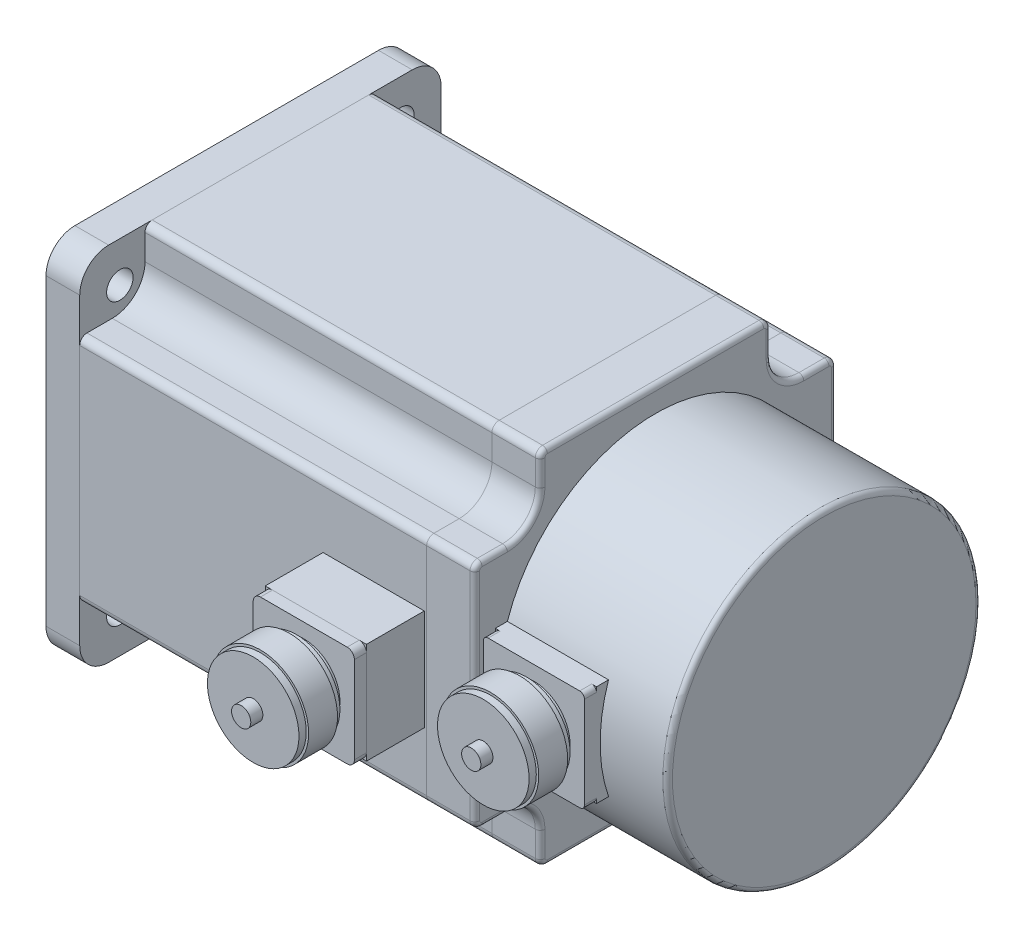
SolidWorks part; units mm, degrees
ref_plane "前视基准面" through (0, 0, 0) normal (0, 0, 1) x (1, 0, 0)
ref_plane "上视基准面" through (0, 0, 0) normal (0, 1, 0) x (1, 0, 0)
ref_plane "右视基准面" through (0, 0, 0) normal (1, 0, 0) x (0, 0, -1)
sketch "草图1" plane through (0, 0, 0) normal (1, 0, 0) x (0, 0, -1)
  line L1 (-63, -75) -> (63, -75)
  line L2 (-75, -63) -> (-75, 63)
  line L3 (-63, 75) -> (63, 75)
  line L4 (75, -63) -> (75, 63)
  line L5 (-75, -75) -> (75, 75) construction
  line L6 (-75, 75) -> (75, -75) construction
  arc A0 (63, -75) -> (75, -63) centre (63, -63) ccw
  arc A1 (-63, -75) -> (-75, -63) centre (-63, -63) cw
  arc A2 (-75, 63) -> (-63, 75) centre (-63, 63) cw
  arc A3 (63, 75) -> (75, 63) centre (63, 63) cw
  point P0 (0, 0)
  dimension "D1" = 12
extrude "凸台-拉伸1" add sketch "草图1" along normal blind 20
sketch "草图2" plane through (0, 0, 0) normal (-1, 0, 0) x (0, 0, 1)
  line L0 (-63, 75) -> (63, 75) construction
  line L1 (-63, -75) -> (63, -75)
  line L2 (-75, -63) -> (-75, 63)
  line L3 (-63, 75) -> (63, 75)
  line L4 (75, -63) -> (75, 63)
  line L5 (-75, -75) -> (75, 75) construction
  line L6 (-75, 75) -> (75, -75) construction
  arc A0 (63, 75) -> (75, 63) centre (63, 63) cw
  arc A1 (63, -75) -> (75, -63) centre (63, -63) ccw
  arc A2 (-63, -75) -> (-75, -63) centre (-63, -63) cw
  arc A3 (-75, 63) -> (-63, 75) centre (-63, 63) cw
  point P0 (0, 0)
  dimension "D1" = 12
extrude "凸台-拉伸2" add sketch "草图2" along normal blind 144 separate body
sketch "草图3" plane through (-144, 0, 0) normal (-1, 0, 0) x (0, 0, 1)
  line L0 (63, 75) -> (-63, 75) construction
  line L1 (-63, -75) -> (63, -75)
  line L2 (-75, -63) -> (-75, 63)
  line L3 (-63, 75) -> (63, 75)
  line L4 (75, -63) -> (75, 63)
  line L5 (-75, -75) -> (75, 75) construction
  line L6 (-75, 75) -> (75, -75) construction
  arc A0 (-63, -75) -> (-75, -63) centre (-63, -63) cw
  arc A1 (63, -75) -> (75, -63) centre (63, -63) ccw
  arc A2 (63, 75) -> (75, 63) centre (63, 63) cw
  arc A3 (-75, 63) -> (-63, 75) centre (-63, 63) cw
  point P0 (0, 0)
  dimension "D1" = 12
extrude "凸台-拉伸3" add sketch "草图3" along normal blind 14 separate body
sketch "草图4" plane through (0, 0, 75) normal (0, 0, 1) x (1, 0, 0)
  line L2 (-43, -21) -> (-1, -21)
  line L3 (-43, -21) -> (-43, 21)
  line L4 (-43, 21) -> (-1, 21)
  line L5 (-1, -21) -> (-1, 21)
  line L6 (-43, -21) -> (-1, 21) construction
  line L7 (-43, 21) -> (-1, -21) construction
extrude "凸台-拉伸4" add sketch "草图4" along normal blind 24 separate body
sketch "草图5" plane through (0, 0, 99) normal (0, 0, 1) x (1, 0, 0)
  line L0 (-1, 21) -> (-43, 21) construction
  line L1 (-40, -21) -> (-4, -21)
  line L2 (-43, -18) -> (-43, 18)
  line L3 (-40, 21) -> (-4, 21)
  line L4 (-1, -18) -> (-1, 18)
  line L5 (-43, -21) -> (-1, 21) construction
  line L6 (-43, 21) -> (-1, -21) construction
  arc A0 (-40, -21) -> (-43, -18) centre (-40, -18) cw
  arc A1 (-4, -21) -> (-1, -18) centre (-4, -18) ccw
  arc A2 (-4, 21) -> (-1, 18) centre (-4, 18) cw
  arc A3 (-43, 18) -> (-40, 21) centre (-40, 18) cw
  point P0 (-22, 0)
  dimension "D1" = 3
extrude "凸台-拉伸5" add sketch "草图5" along normal blind 5 separate body
sketch "草图6" plane through (0, 0, 104) normal (0, 0, 1) x (1, 0, 0)
  circle A0 centre (-22, 0) radius 15
extrude "凸台-拉伸6" add sketch "草图6" along normal blind 3 separate body
sketch "草图7" plane through (0, 0, 107) normal (0, 0, 1) x (1, 0, 0)
  circle A0 centre (-22, 0) radius 18
extrude "凸台-拉伸7" add sketch "草图7" along normal blind 3 separate body
sketch "草图8" plane through (0, 0, 110) normal (0, 0, 1) x (1, 0, 0)
  circle A0 centre (-22, 0) radius 20
extrude "凸台-拉伸8" add sketch "草图8" along normal blind 12 separate body
sketch "草图9" plane through (0, 0, 122) normal (0, 0, 1) x (1, 0, 0)
  circle A0 centre (-22, 0) radius 19
extrude "凸台-拉伸9" add sketch "草图9" along normal blind 3
sketch "草图10" plane through (0, 0, 125) normal (0, 0, 1) x (1, 0, 0)
  circle A0 centre (-22, 0) radius 4
extrude "凸台-拉伸10" add sketch "草图10" along normal blind 5
sketch "草图11" plane through (20, 0, 0) normal (1, 0, 0) x (0, 0, -1)
  line L0 (47.9169, -61.5) -> (47.9169, -72)
  line L1 (-75, -44.9169) -> (-75, -63)
  line L2 (-63, -75) -> (-44.9169, -75)
  line L3 (44.9169, -75) -> (63, -75)
  line L4 (75, -63) -> (75, -44.9169)
  line L6 (75, 63) -> (75, 44.9169)
  line L7 (-63, -75) -> (63, -75) construction
  line L8 (63, 75) -> (44.9169, 75)
  line L9 (-47.9169, -72) -> (-47.9169, -61.5)
  line L10 (-44.9169, 75) -> (-63, 75)
  line L11 (-61.5, -47.9169) -> (-72, -47.9169)
  line L12 (75, -63) -> (75, 63) construction
  line L13 (-75, 63) -> (-75, 44.9169)
  line L14 (-72, 47.9169) -> (-61.5, 47.9169)
  line L16 (-47.9169, 61.5) -> (-47.9169, 72)
  line L17 (63, 75) -> (-63, 75) construction
  line L19 (47.9169, 72) -> (47.9169, 61.5)
  line L21 (61.5, 47.9169) -> (72, 47.9169)
  line L22 (-75, 63) -> (-75, -63) construction
  line L24 (72, -47.9169) -> (61.5, -47.9169)
  arc A0 (-61.5, 47.9169) -> (-47.9169, 61.5) centre (-61.5, 61.5) ccw
  arc A1 (47.9169, 61.5) -> (61.5, 47.9169) centre (61.5, 61.5) ccw
  arc A2 (-47.9169, -61.5) -> (-61.5, -47.9169) centre (-61.5, -61.5) ccw
  arc A3 (-72, -47.9169) -> (-75, -44.9169) centre (-72, -44.9169) cw
  arc A4 (61.5, -47.9169) -> (47.9169, -61.5) centre (61.5, -61.5) ccw
  arc A5 (-75, 44.9169) -> (-72, 47.9169) centre (-72, 44.9169) cw
  arc A6 (-47.9169, 72) -> (-44.9169, 75) centre (-44.9169, 72) cw
  arc A7 (44.9169, 75) -> (47.9169, 72) centre (44.9169, 72) cw
  arc A8 (72, 47.9169) -> (75, 44.9169) centre (72, 44.9169) cw
  arc A9 (75, -44.9169) -> (72, -47.9169) centre (72, -44.9169) cw
  arc A10 (47.9169, -72) -> (44.9169, -75) centre (44.9169, -72) cw
  arc A11 (-44.9169, -75) -> (-47.9169, -72) centre (-44.9169, -72) cw
  arc A12 (-63, 75) -> (-75, 63) centre (-63, 63) ccw
  arc A13 (75, 63) -> (63, 75) centre (63, 63) ccw
  arc A14 (63, -75) -> (75, -63) centre (63, -63) ccw
  arc A15 (-75, -63) -> (-63, -75) centre (-63, -63) ccw
  point P0 (0, 0)
  point P1 (0, 0)
  point P12 (-75, -47.9169)
  point P43 (-75, 47.9169)
  point P47 (-47.9169, 75)
  point P48 (51.9891, -75)
  point P52 (47.9169, 75)
  point P56 (75, 47.9169)
  point P65 (75, -47.9169)
  point P82 (-47.9169, -75)
  dimension "D1" = 3
extrude "切除-拉伸2" cut sketch "草图11" against normal blind 164
fillet "圆角1" radius 2 24 edges at (20, 75, 0) (20, 0, -75) (20, -75, 0) (20, 0, 75) (20, 47.0382, 74.1213) (20, 47.9169, 66.75) (20, 51.8953, 51.8953) (20, 66.75, 47.9169) (20, 74.1213, 47.0382) (20, 74.1213, -47.0382) (20, 66.75, -47.9169) (20, 51.8953, -51.8953) (20, 47.9169, -66.75) (20, 47.0382, -74.1213) (20, -47.0382, -74.1213) (20, -47.9169, -66.75) (20, -51.8953, -51.8953) (20, -66.75, -47.9169) (20, -74.1213, -47.0382) (20, -74.1213, 47.0382) (20, -66.75, 47.9169) (20, -51.8953, 51.8953) (20, -47.9169, 66.75) (20, -47.0382, 74.1213)
sketch "草图12" plane through (-158, 0, 0) normal (-1, 0, 0) x (0, 0, 1)
  circle A2 centre (-58.3363, 58.3363) radius 5.5
  circle A3 centre (58.3363, 58.3363) radius 5.5
  circle A4 centre (58.3363, -58.3363) radius 5.5
  circle A5 centre (-58.3363, -58.3363) radius 5.5
extrude "切除-拉伸3" cut sketch "草图12" against normal blind 14
sketch "草图13" plane through (-158, 0, 0) normal (-1, 0, 0) x (0, 0, 1)
  circle A0 centre (0, 0) radius 65
  circle A1 centre (0, 0) radius 57.5
extrude "凸台-拉伸11" add sketch "草图13" along normal blind 5 separate body
sketch "草图14" plane through (-158, 0, 0) normal (-1, 0, 0) x (0, 0, 1)
  circle A0 centre (0, 0) radius 35
extrude "凸台-拉伸12" add sketch "草图14" along normal blind 5
sketch "草图15" plane through (-163, 0, 0) normal (-1, 0, 0) x (0, 0, 1)
  circle A0 centre (0, 0) radius 17.5
extrude "凸台-拉伸13" add sketch "草图15" along normal blind 0.5 separate body
fillet "圆角2" radius 0.5 1 edges at (-163.5, 0, 17.5)
sketch "草图16" plane through (-163.5, 0, 0) normal (-1, 0, 0) x (0, 0, 1)
  circle A0 centre (0, 0) radius 14
extrude "凸台-拉伸14" add sketch "草图16" along normal blind 52.5
chamfer "倒角1" distance 0.5 angle 45 1 edges at (-216, 0, 14)
ref_plane "基准面1" through (0, -14, 0) normal (0, 1, 0) x (1, 0, 0)
sketch "草图19" plane through (20, 0, 0) normal (1, 0, 0) x (0, 0, -1)
  circle A0 centre (0, 0) radius 65
extrude "凸台-拉伸16" add sketch "草图19" along normal blind 70 separate body
fillet "圆角3" radius 2 1 edges at (90, 0, -65)
ref_plane "基准面2" through (0, 0, 65) normal (0, 0, 1) x (1, 0, 0)
sketch "草图20" plane through (0, 0, 65) normal (0, 0, 1) x (1, 0, 0)
  line L1 (20, 65) -> (20, -65) construction
  line L3 (62, -21) -> (20, -21)
  line L4 (62, -21) -> (62, 21)
  line L5 (62, 21) -> (20, 21)
  line L6 (20, -21) -> (20, 21)
  line L7 (62, -21) -> (20, 21) construction
  line L8 (62, 21) -> (20, -21) construction
extrude "切除-拉伸5" cut sketch "草图20" against normal blind 10
sketch "草图21" plane through (0, 0, 55) normal (0, 0, 1) x (1, 0, 0)
  line L0 (62, 21) -> (20, 21) construction
  line L1 (20, -21) -> (62, -21)
  line L2 (20, -21) -> (20, 21)
  line L3 (20, 21) -> (62, 21)
  line L4 (62, -21) -> (62, 21)
  line L5 (20, -21) -> (62, 21) construction
  line L6 (20, 21) -> (62, -21) construction
  line L7 (20, 21) -> (62, 21) construction
  point P0 (41, 0)
extrude "凸台-拉伸17" add sketch "草图21" along normal blind 11.5
sketch "草图22" plane through (0, 0, 66.5) normal (0, 0, 1) x (1, 0, 0)
  line L0 (62, -21) -> (62, 21) construction
  line L1 (22, -21) -> (60, -21)
  line L2 (20, -19) -> (20, 19)
  line L3 (22, 21) -> (60, 21)
  line L4 (62, -19) -> (62, 19)
  line L5 (20, -21) -> (62, 21) construction
  line L6 (20, 21) -> (62, -21) construction
  line L7 (20, 21) -> (62, 21) construction
  arc A0 (22, -21) -> (20, -19) centre (22, -19) cw
  arc A1 (60, -21) -> (62, -19) centre (60, -19) ccw
  arc A2 (60, 21) -> (62, 19) centre (60, 19) cw
  arc A3 (20, 19) -> (22, 21) centre (22, 19) cw
  point P0 (41, 0)
  dimension "D1" = 2
extrude "凸台-拉伸18" add sketch "草图22" along normal blind 5 separate body
sketch "草图23" plane through (0, 0, 71.5) normal (0, 0, 1) x (1, 0, 0)
  circle A0 centre (41, 0) radius 15
extrude "凸台-拉伸19" add sketch "草图23" along normal blind 3
sketch "草图24" plane through (0, 0, 74.5) normal (0, 0, 1) x (1, 0, 0)
  circle A0 centre (41, 0) radius 18
extrude "凸台-拉伸20" add sketch "草图24" along normal blind 3
sketch "草图25" plane through (0, 0, 77.5) normal (0, 0, 1) x (1, 0, 0)
  circle A0 centre (41, 0) radius 20
extrude "凸台-拉伸21" add sketch "草图25" along normal blind 12
sketch "草图26" plane through (0, 0, 89.5) normal (0, 0, 1) x (1, 0, 0)
  circle A0 centre (41, 0) radius 19
extrude "凸台-拉伸22" add sketch "草图26" along normal blind 3
sketch "草图27" plane through (0, 0, 92.5) normal (0, 0, 1) x (1, 0, 0)
  circle A0 centre (41, 0) radius 4
extrude "凸台-拉伸23" add sketch "草图27" along normal blind 5
sketch "草图33" plane through (0, -14, 0) normal (0, 1, 0) x (1, 0, 0)
  line L3 (-208, -4) -> (-171, -4)
  line L5 (-171, 4) -> (-208, 4)
  arc A0 (-208, 4) -> (-208, -4) centre (-208, 0) ccw
  arc A1 (-171, -4) -> (-171, 4) centre (-171, 0) ccw
extrude "切除-拉伸8" cut sketch "草图33" along normal blind 5
sketch "草图34" plane through (0, -9, 0) normal (0, -1, 0) x (1, 0, 0)
  line L0 (-208, 4) -> (-171, 4)
  line L2 (-171, -4) -> (-208, -4)
  arc A0 (-208, 4) -> (-208, -4) centre (-208, 0) ccw
  arc A1 (-171, -4) -> (-171, 4) centre (-171, 0) ccw
extrude "凸台-拉伸25" add sketch "草图34" along normal blind 8 separate body
